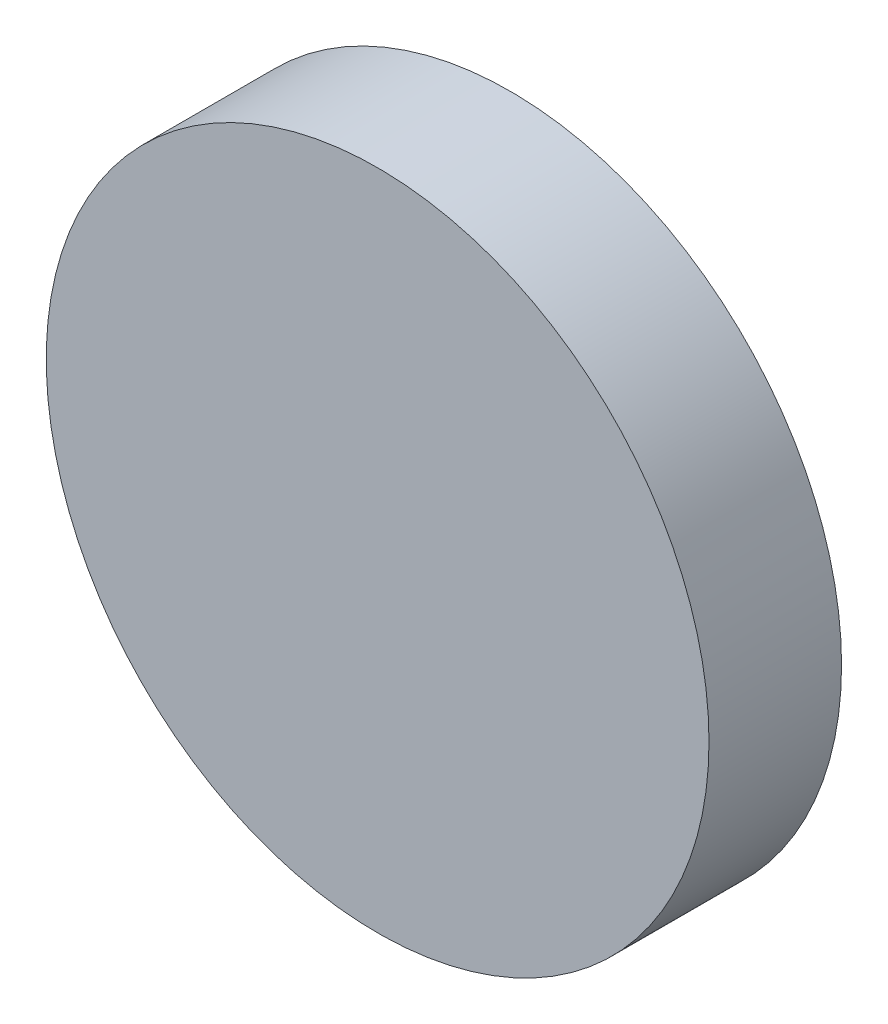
SolidWorks part; units mm, degrees
ref_plane "Front Plane" through (0, 0, 0) normal (0, 0, 1) x (1, 0, 0)
ref_plane "Top Plane" through (0, 0, 0) normal (0, 1, 0) x (1, 0, 0)
ref_plane "Right Plane" through (0, 0, 0) normal (1, 0, 0) x (0, 0, -1)
sketch "Sketch1" plane through (0, 0, 0) normal (0, 0, 1) x (1, 0, 0)
  circle A0 centre (0, 0) radius 25
  dimension "D1" = 50
extrude "Extrude1" add sketch "Sketch1" along normal blind 10
